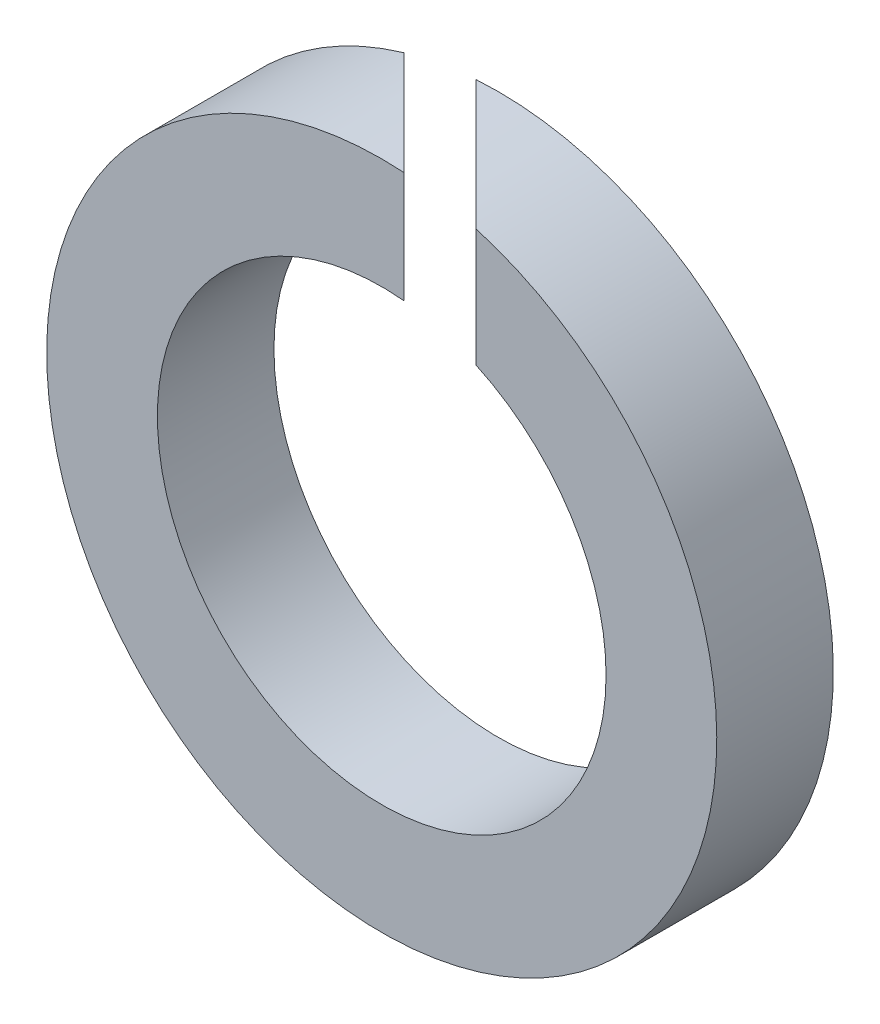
SolidWorks part; units mm, degrees
ref_plane "Plane1" through (0, 0, 0) normal (0, 0, 1) x (1, 0, 0)
ref_plane "Plane2" through (0, 0, 0) normal (0, 1, 0) x (1, 0, 0)
ref_plane "Plane3" through (0, 0, 0) normal (1, 0, 0) x (0, 0, -1)
sketch "Esquisse1" plane through (0, 0, 0) normal (0, 0, 1) x (1, 0, 0)
  circle A0 centre (0, 0) radius 11.5
  dimension "D1" = 23
extrude "Base-Extrusion" add sketch "Esquisse1" along normal blind 4
sketch "Esquisse2" plane through (0, 0, 4) normal (0, 0, 1) x (1, 0, 0)
  circle A0 centre (0, 0) radius 7
  dimension "D1" = 14
extrude "Enlèv. mat.-Extru.1" cut sketch "Esquisse2" against normal through all
sketch "Esquisse3" plane through (0, 0, 0) normal (0, 1, 0) x (1, 0, 0)
  line L0 (0, -2) -> (0, 10.2427) construction
  line L2 (0, -4) -> (0, 0) construction
  line L3 (-11.5, -2) -> (11.5, -2) construction
  line L6 (-11.5, 0) -> (-11.5, -4) construction
  line L7 (11.5, -4) -> (11.5, 0) construction
  line L8 (0, -2) -> (9.7133, -11.7133) construction
  line L9 (-3.2374, 0) -> (0.7626, -4)
  line L10 (7, 0) -> (-7, 0) construction
  line L11 (-11.5, -4) -> (11.5, -4) construction
  line L12 (-0.7626, 0) -> (3.2374, -4)
  line L13 (-0.7626, 0) -> (-3.2374, 0)
  line L14 (0.7626, -4) -> (3.2374, -4)
  dimension "D1" = 135
  dimension "D2" = 1.75
extrude "Enlèv. mat.-Extru.2" cut sketch "Esquisse3" along normal through all
sketch "Esquisse4" plane through (0, 0, 0) normal (0, 0, -1) x (-1, 0, 0)
  circle A0 centre (0, 0) radius 7.7
  dimension "D1" = 15.4
extrude "Enlèv. mat.-Extru.3" cut sketch "Esquisse4" against normal through all
equation "\"D2@Esquisse3\" = \"D1@Esquisse2\"/8"
equation "\"D1@Esquisse4\" = \"D1@Esquisse2\"*1.1"
